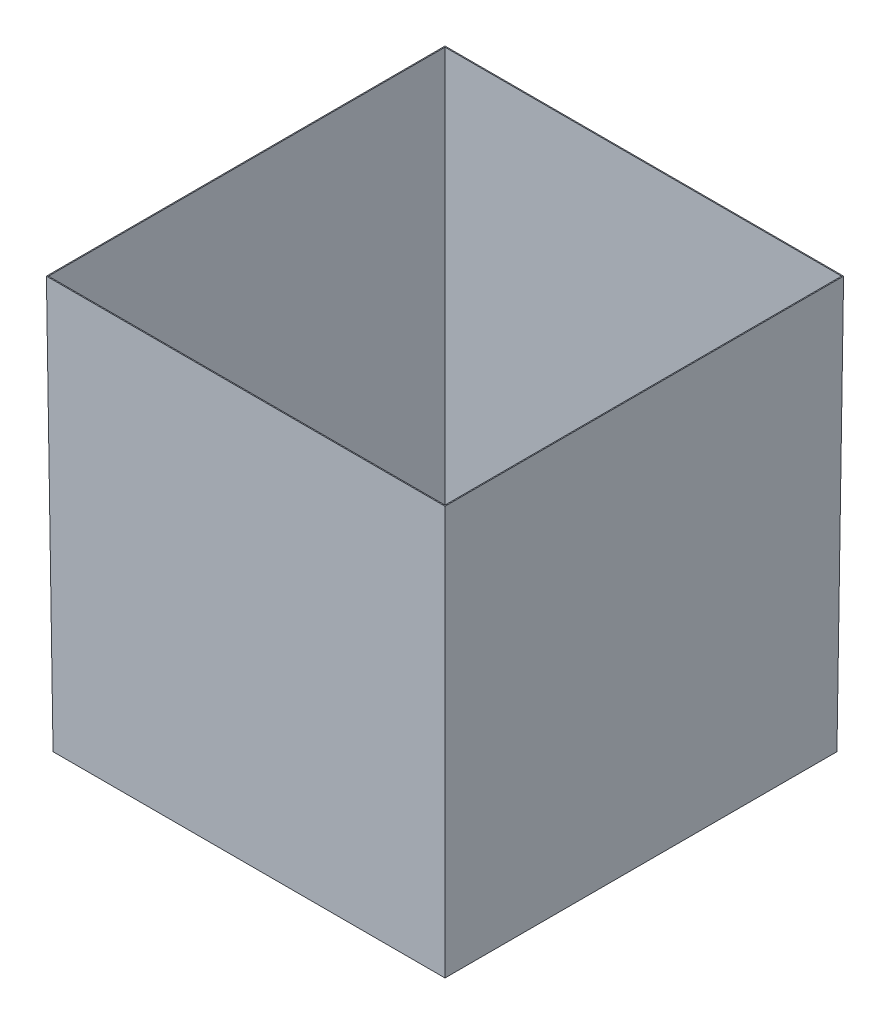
SolidWorks part; units mm, degrees
ref_plane "Спереди" through (0, 0, 0) normal (0, 0, 1) x (1, 0, 0)
ref_plane "Сверху" through (0, 0, 0) normal (0, 1, 0) x (1, 0, 0)
ref_plane "Справа" through (0, 0, 0) normal (1, 0, 0) x (0, 0, -1)
other "Configuration Table"
sketch "Эскиз1" plane through (0, 0, 0) normal (0, 1, 0) x (1, 0, 0)
  line L1 (-295, -295) -> (295, -295)
  line L2 (-295, -295) -> (-295, 295)
  line L3 (-295, 295) -> (295, 295)
  line L4 (295, -295) -> (295, 295)
ref_plane "Плоскость1" through (0, 620, 0) normal (0, 1, 0) x (1, 0, 0)
sketch "Эскиз2" plane through (0, 620, 0) normal (0, 1, 0) x (1, 0, 0)
  line L1 (-300, -300) -> (300, -300)
  line L2 (-300, -300) -> (-300, 300)
  line L3 (-300, 300) -> (300, 300)
  line L4 (300, -300) -> (300, 300)
loft "Корпус 590-600, H620" add profiles "Эскиз1", "Эскиз2"
shell "Стенка и дно 1,5 мм" thickness 1.5
